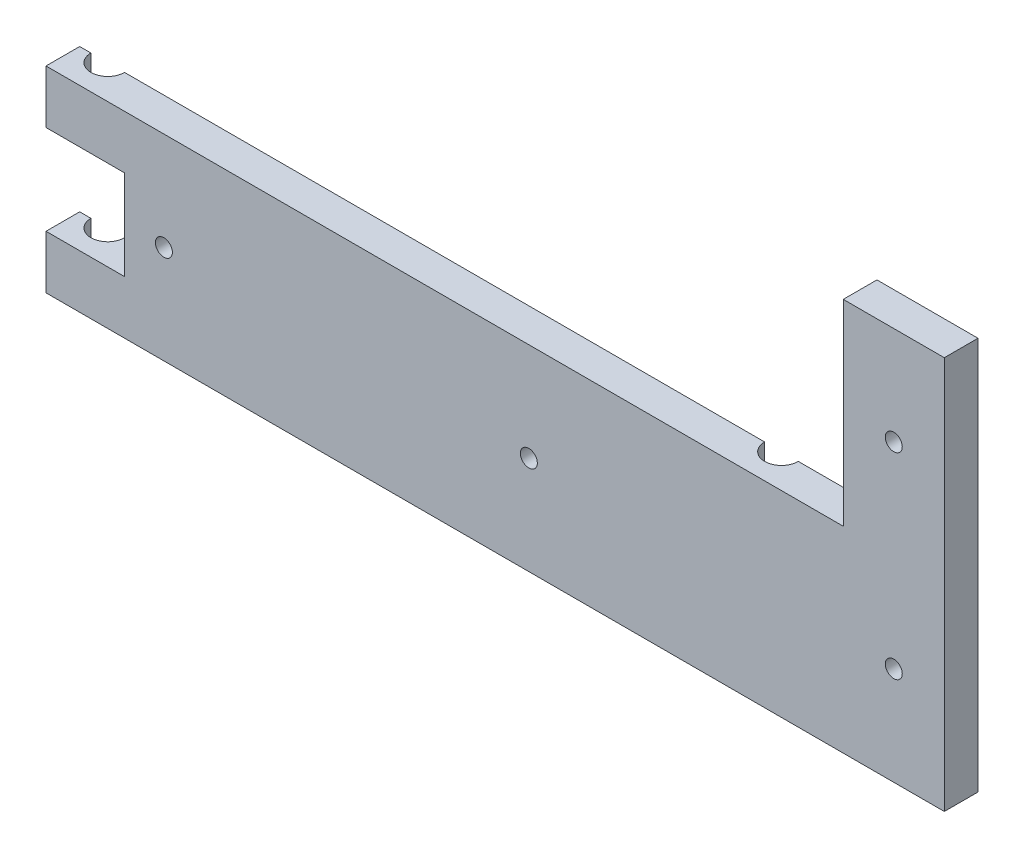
SolidWorks part; units mm, degrees
ref_plane "Plan de face" through (0, 0, 0) normal (0, 0, 1) x (1, 0, 0)
ref_plane "Plan de dessus" through (0, 0, 0) normal (0, 1, 0) x (1, 0, 0)
ref_plane "Plan de droite" through (0, 0, 0) normal (1, 0, 0) x (0, 0, -1)
sketch "Esquisse1" plane through (0, 0, 0) normal (0, 0, 1) x (1, 0, 0)
  line L0 (9, 126.1328) -> (9, -9.4638) construction
  line L1 (0, 0) -> (160, 0) construction
  line L2 (0, 0) -> (0, 120) construction
  line L3 (0, 120) -> (160, 120) construction
  line L4 (120, 50) -> (120, -6.9153) construction
  line L5 (-5, 121) -> (-5, -10) construction
  line L6 (-10.714, 17.5) -> (132.8358, 17.5) construction
  line L7 (155, 136.9664) -> (155, -26.1058) construction
  line L8 (137, 80.6011) -> (137, -4.7242) construction
  line L9 (-16.256, 70) -> (160, 70) construction
  line L10 (-9.4797, 25.5) -> (13.4274, 25.5) construction
  line L11 (153.523, 35) -> (-16.256, 35) construction
  line L12 (155, 70) -> (137, 70)
  line L13 (13.4274, 9.5) -> (-9.4797, 9.5) construction
  line L14 (137, 70) -> (137, 35)
  line L15 (137, 35) -> (-5, 35)
  line L16 (-5, 35) -> (-5, 25.5)
  line L17 (-5, 25.5) -> (9, 25.5)
  line L18 (9, 25.5) -> (9, 9.5)
  line L19 (9, 9.5) -> (-5, 9.5)
  line L20 (-5, 9.5) -> (-5, 0)
  line L21 (-5, 0) -> (155, 0)
  line L22 (155, 0) -> (155, 70)
  line L23 (146, 60) -> (146, -7.9939) construction
  circle A0 centre (146, 17.5) radius 1.51
  circle A1 centre (146, 52.5) radius 1.51
  circle A2 centre (81, 17.5) radius 1.51
  circle A3 centre (16, 17.5) radius 1.51
  dimension "D1" = 18
  dimension "D2" = 8
  dimension "D3" = 8
extrude "Extrusion1" add sketch "Esquisse1" along normal blind 6
sketch "Esquisse2" plane through (0, 0, 0) normal (0, -1, 0) x (1, 0, 0)
  circle A0 centre (0, 0) radius 3
  circle A1 centre (120, 0) radius 3
extrude "Enlèv. mat.-Extru.1" cut sketch "Esquisse2" against normal through all
